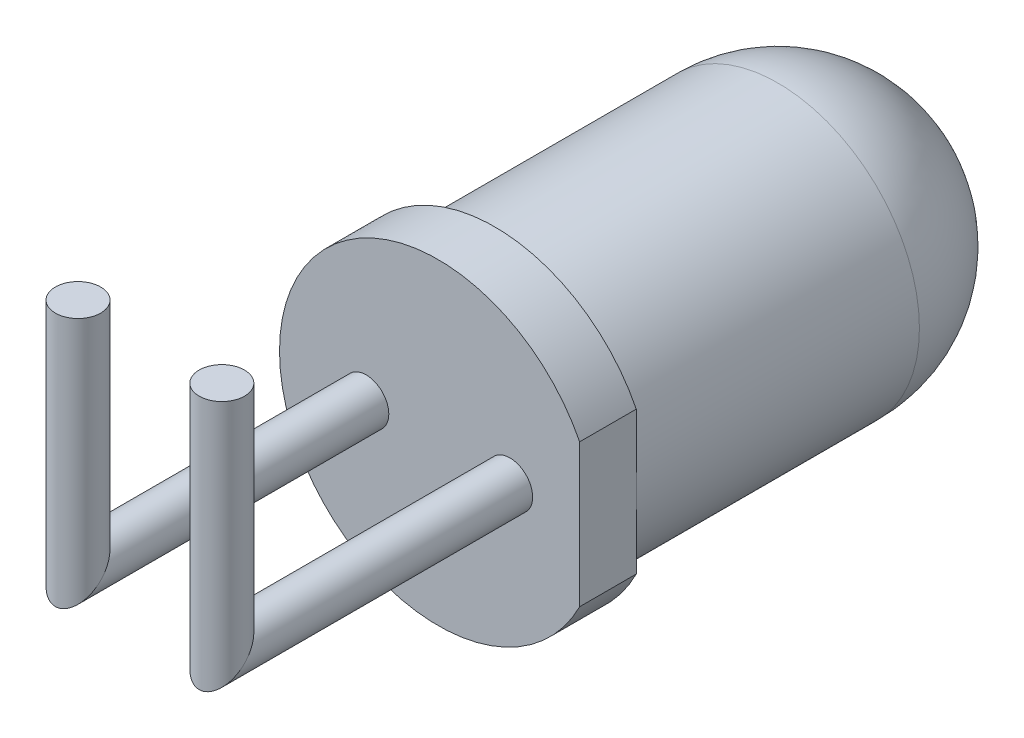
SolidWorks part; units mm, degrees
ref_plane "Face" through (0, 0, 0) normal (0, 0, 1) x (1, 0, 0)
ref_plane "Dessus" through (0, 0, 0) normal (0, 1, 0) x (1, 0, 0)
ref_plane "Droite" through (0, 0, 0) normal (1, 0, 0) x (0, 0, -1)
sketch "Esquisse1" plane through (0, 0, 0) normal (0, 0, 1) x (1, 0, 0)
  circle A0 centre (0, 0) radius 2.5
extrude "Base-Extrusion" add sketch "Esquisse1" along normal blind 8.5
sketch "Esquisse2" plane through (0, 0, 8.5) normal (0, 0, 1) x (1, 0, 0)
  line L0 (2.5, -2.4917) -> (2.5, 2.5621) construction
  line L1 (2.5, 1.261) -> (2.5, -1.261)
  arc A0 (2.5, 1.261) -> (2.5, -1.261) centre (0, 0) ccw
extrude "Boss.-Extru.1" add sketch "Esquisse2" against normal blind 1
fillet "Congé1" radius 2.5 1 edges at (2.5, 0, 0)
sketch "Esquisse3" plane through (0, 0, 8.5) normal (0, 0, 1) x (1, 0, 0)
  line L0 (0, 0.821) -> (0, -0.6443) construction
  circle A0 centre (-1.27, 0) radius 0.4
  circle A1 centre (1.27, 0) radius 0.4
  dimension "D1" = 0.8
  dimension "D2" = 2.54
sketch "Esquisse4" plane through (0, 0, 0) normal (1, 0, 0) x (0, 0, -1)
  line L0 (-8.5, 0.0884) -> (-13.5, 0.0884)
  line L1 (-8.5, 0.821) -> (-8.5, -0.6443) construction
  line L2 (-13.5, 0.0884) -> (-13.5, 4.0884)
  dimension "D1" = 5
  dimension "D2" = 4
sweep "Balayage1" add profiles "Esquisse3" path "Esquisse4"
